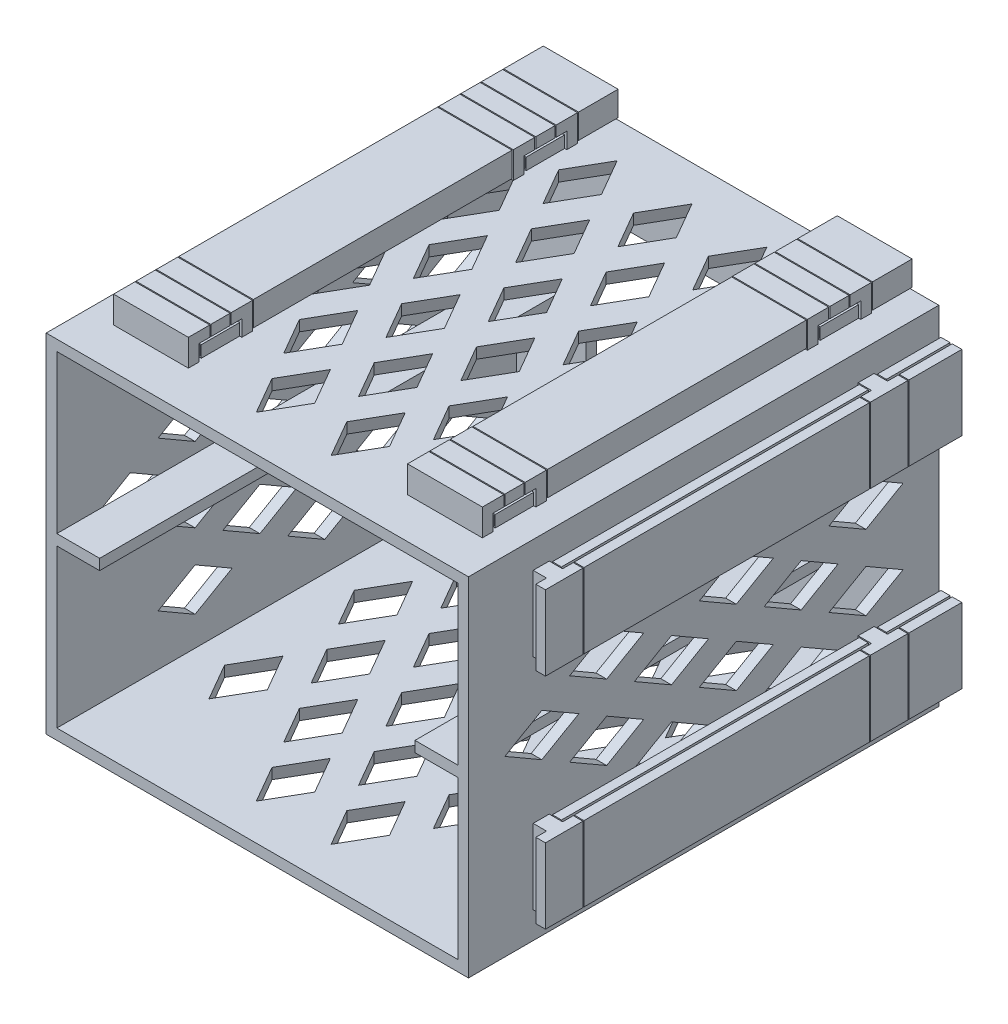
SolidWorks part; units mm, degrees
ref_plane "Alzado" through (0, 0, 0) normal (0, 0, 1) x (1, 0, 0)
ref_plane "Planta" through (0, 0, 0) normal (0, 1, 0) x (1, 0, 0)
ref_plane "Vista lateral" through (0, 0, 0) normal (1, 0, 0) x (0, 0, -1)
sketch "Croquis1" plane through (0, 0, 0) normal (0, 0, -1) x (-1, 0, 0)
  line L1 (-39.5, 32.5) -> (39.5, 32.5)
  line L2 (-39.5, 32.5) -> (-39.5, -32.5)
  line L3 (-39.5, -32.5) -> (39.5, -32.5)
  line L4 (39.5, 32.5) -> (39.5, -32.5)
  line L7 (-24.5, 17.5) -> (24.5, 17.5)
  line L8 (-24.5, 17.5) -> (-24.5, -17.5)
  line L9 (-24.5, -17.5) -> (24.5, -17.5)
  line L10 (24.5, 17.5) -> (24.5, -17.5)
extrude "Fondo" add sketch "Croquis1" against normal blind 2 separate body
sketch "Croquis3" plane through (0, 0, 2) normal (0, 0, 1) x (1, 0, 0)
  line L1 (-39.5, 32.5) -> (39.5, 32.5)
  line L2 (-39.5, 32.5) -> (-39.5, -32.5)
  line L3 (-39.5, -32.5) -> (39.5, -32.5)
  line L4 (39.5, 32.5) -> (39.5, -32.5)
  line L6 (-37.5, 30.5) -> (-37.5, -30.5)
  line L7 (-37.5, 30.5) -> (37.5, 30.5)
  line L8 (37.5, 30.5) -> (37.5, -30.5)
  line L9 (-37.5, -30.5) -> (37.5, -30.5)
extrude "Estructura" add sketch "Croquis3" along normal blind 86
sketch "Croquis5" plane through (-39.5, 0, 0) normal (-1, 0, 0) x (0, 0, 1)
  line L0 (13.628, 25) -> (20.556, 21)
  line L1 (20.556, 21) -> (13.628, 17)
  line L2 (13.628, 17) -> (6.7, 21)
  line L3 (6.7, 21) -> (13.628, 25)
  line L4 (0, -32.5) -> (0, 32.5) construction
  line L5 (88, 32.5) -> (0, 32.5) construction
  line L6 (13.628, 11) -> (20.556, 7)
  line L7 (6.7, 7) -> (13.628, 11)
  line L8 (13.628, 3) -> (6.7, 7)
  line L9 (20.556, 7) -> (13.628, 3)
  line L10 (13.628, -3) -> (20.556, -7)
  line L11 (6.7, -7) -> (13.628, -3)
  line L12 (13.628, -11) -> (6.7, -7)
  line L13 (20.556, -7) -> (13.628, -11)
  line L14 (13.628, -17) -> (20.556, -21)
  line L15 (6.7, -21) -> (13.628, -17)
  line L16 (13.628, -25) -> (6.7, -21)
  line L17 (20.556, -21) -> (13.628, -25)
  line L18 (37.884, 25) -> (44.812, 21)
  line L19 (44.812, 21) -> (37.884, 17)
  line L20 (37.884, 17) -> (30.956, 21)
  line L21 (30.956, 21) -> (37.884, 25)
  line L22 (44.812, 7) -> (37.884, 3)
  line L23 (37.884, 11) -> (44.812, 7)
  line L24 (30.956, 7) -> (37.884, 11)
  line L25 (37.884, 3) -> (30.956, 7)
  line L26 (44.812, -7) -> (37.884, -11)
  line L27 (37.884, -3) -> (44.812, -7)
  line L28 (30.956, -7) -> (37.884, -3)
  line L29 (37.884, -11) -> (30.956, -7)
  line L30 (37.884, -17) -> (44.812, -21)
  line L31 (44.812, -21) -> (37.884, -25)
  line L32 (37.884, -25) -> (30.956, -21)
  line L33 (30.956, -21) -> (37.884, -17)
  line L34 (62.14, 25) -> (69.068, 21)
  line L35 (69.068, 21) -> (62.14, 17)
  line L36 (62.14, 17) -> (55.212, 21)
  line L37 (55.212, 21) -> (62.14, 25)
  line L38 (69.068, 7) -> (62.14, 3)
  line L39 (62.14, 11) -> (69.068, 7)
  line L40 (55.212, 7) -> (62.14, 11)
  line L41 (62.14, 3) -> (55.212, 7)
  line L42 (69.068, -7) -> (62.14, -11)
  line L43 (62.14, -3) -> (69.068, -7)
  line L44 (55.212, -7) -> (62.14, -3)
  line L45 (62.14, -11) -> (55.212, -7)
  line L46 (62.14, -17) -> (69.068, -21)
  line L47 (69.068, -21) -> (62.14, -25)
  line L48 (62.14, -25) -> (55.212, -21)
  line L49 (55.212, -21) -> (62.14, -17)
  line L66 (50.012, 18) -> (56.94, 14)
  line L67 (56.94, 14) -> (50.012, 10)
  line L68 (50.012, 10) -> (43.084, 14)
  line L69 (43.084, 14) -> (50.012, 18)
  line L70 (50.012, 4) -> (56.94, 0)
  line L71 (43.084, 0) -> (50.012, 4)
  line L72 (50.012, -4) -> (43.084, 0)
  line L73 (56.94, -14) -> (50.012, -18)
  line L74 (50.012, -10) -> (56.94, -14)
  line L75 (43.084, -14) -> (50.012, -10)
  line L76 (18.828, 14) -> (25.756, 18)
  line L77 (67.34, 14) -> (74.268, 18) construction
  line L78 (67.34, -14) -> (74.268, -10) construction
  line L79 (74.268, -18) -> (67.34, -14) construction
  line L80 (25.756, 4) -> (32.684, 0)
  line L81 (18.828, 0) -> (25.756, 4)
  line L82 (25.756, -4) -> (18.828, 0)
  line L83 (32.684, 0) -> (25.756, -4)
  line L84 (25.756, -18) -> (18.828, -14)
  line L85 (32.684, -14) -> (25.756, -18)
  line L86 (56.94, 0) -> (50.012, -4)
  line L87 (50.012, -18) -> (43.084, -14)
  line L88 (32.684, 14) -> (25.756, 10)
  line L89 (25.756, 10) -> (18.828, 14)
  line L90 (25.756, 18) -> (32.684, 14)
  line L91 (74.268, 18) -> (81.196, 14) construction
  line L92 (81.196, 14) -> (74.268, 10) construction
  line L93 (74.268, 10) -> (67.34, 14) construction
  line L94 (81.196, 0) -> (74.268, -4)
  line L95 (74.268, 4) -> (81.196, 0)
  line L96 (67.34, 0) -> (74.268, 4)
  line L97 (74.268, -4) -> (67.34, 0)
  line L98 (81.196, -14) -> (74.268, -18) construction
  line L99 (74.268, -10) -> (81.196, -14) construction
  line L100 (25.756, -10) -> (32.684, -14)
  line L101 (18.828, -14) -> (25.756, -10)
  line L102 (88, 32.5) -> (0, 32.5) construction
  line L103 (86.396, 25) -> (93.324, 21)
  line L104 (93.324, 21) -> (86.396, 17)
  line L105 (86.396, 17) -> (79.468, 21)
  line L106 (79.468, 21) -> (86.396, 25)
  line L107 (93.324, 7) -> (86.396, 3)
  line L108 (86.396, 11) -> (93.324, 7)
  line L109 (79.468, 7) -> (86.396, 11)
  line L110 (86.396, 3) -> (79.468, 7)
  line L111 (93.324, -7) -> (86.396, -11)
  line L112 (86.396, -3) -> (93.324, -7)
  line L113 (79.468, -7) -> (86.396, -3)
  line L114 (86.396, -11) -> (79.468, -7)
  line L115 (86.396, -17) -> (93.324, -21)
  line L116 (93.324, -21) -> (86.396, -25)
  line L117 (86.396, -25) -> (79.468, -21)
  line L118 (79.468, -21) -> (86.396, -17)
  dimension "D1" = 7.9998
  dimension "D2" = 7.9998
  dimension "D3" = 6.7
  dimension "D4" = 7.5
  dimension "D5" = 8
  dimension "D7" = 13.856
  dimension "D9" = 24.256
  dimension "D10" = 14.5
  dimension "D11" = 24.256
  dimension "D6" = 4
  dimension "D8" = 4
extrude "RombosHor" cut sketch "Croquis5" against normal up to surface (79 mm away)
sketch "Croquis9" plane through (0, 32.5, 0) normal (0, 1, 0) x (1, 0, 0)
  line L0 (28, -6.6872) -> (24, -13.6154)
  line L1 (28, -6.6872) -> (32, -13.6154)
  line L2 (24, -13.6154) -> (28, -20.5436)
  line L3 (32, -13.6154) -> (28, -20.5436)
  line L4 (14, -6.6872) -> (10, -13.6154)
  line L5 (14, -6.6872) -> (18, -13.6154)
  line L6 (18, -13.6154) -> (14, -20.5436)
  line L7 (10, -13.6154) -> (14, -20.5436)
  line L8 (0, -6.6872) -> (-4, -13.6154)
  line L9 (0, -6.6872) -> (4, -13.6154)
  line L10 (4, -13.6154) -> (0, -20.5436)
  line L11 (-4, -13.6154) -> (0, -20.5436)
  line L12 (-14, -6.6872) -> (-18, -13.6154)
  line L13 (-14, -6.6872) -> (-10, -13.6154)
  line L14 (-10, -13.6154) -> (-14, -20.5436)
  line L15 (-18, -13.6154) -> (-14, -20.5436)
  line L16 (-28, -6.6872) -> (-32, -13.6154)
  line L17 (-28, -6.6872) -> (-24, -13.6154)
  line L18 (-24, -13.6154) -> (-28, -20.5436)
  line L19 (-32, -13.6154) -> (-28, -20.5436)
  line L20 (14, -30.9436) -> (10, -37.8718)
  line L21 (14, -30.9436) -> (18, -37.8718)
  line L22 (18, -37.8718) -> (14, -44.8)
  line L23 (10, -37.8718) -> (14, -44.8)
  line L24 (0, -30.9436) -> (-4, -37.8718)
  line L25 (0, -30.9436) -> (4, -37.8718)
  line L26 (4, -37.8718) -> (0, -44.8)
  line L27 (-4, -37.8718) -> (0, -44.8)
  line L28 (-14, -30.9436) -> (-18, -37.8718)
  line L29 (-14, -30.9436) -> (-10, -37.8718)
  line L30 (-10, -37.8718) -> (-14, -44.8)
  line L31 (-18, -37.8718) -> (-14, -44.8)
  line L32 (-28, -30.9436) -> (-32, -37.8718)
  line L33 (-28, -30.9436) -> (-24, -37.8718)
  line L34 (-24, -37.8718) -> (-28, -44.8)
  line L35 (-32, -37.8718) -> (-28, -44.8)
  line L36 (14, -55.2) -> (10, -62.1282)
  line L37 (14, -55.2) -> (18, -62.1282)
  line L38 (18, -62.1282) -> (14, -69.0564)
  line L39 (10, -62.1282) -> (14, -69.0564)
  line L40 (0, -55.2) -> (-4, -62.1282)
  line L41 (0, -55.2) -> (4, -62.1282)
  line L42 (4, -62.1282) -> (0, -69.0564)
  line L43 (-4, -62.1282) -> (0, -69.0564)
  line L44 (-14, -55.2) -> (-18, -62.1282)
  line L45 (-14, -55.2) -> (-10, -62.1282)
  line L46 (-10, -62.1282) -> (-14, -69.0564)
  line L47 (-18, -62.1282) -> (-14, -69.0564)
  line L48 (-28, -55.2) -> (-32, -62.1282)
  line L49 (-28, -55.2) -> (-24, -62.1282)
  line L50 (-24, -62.1282) -> (-28, -69.0564)
  line L51 (-32, -62.1282) -> (-28, -69.0564)
  line L68 (28, -30.9436) -> (24, -37.8718)
  line L69 (28, -30.9436) -> (32, -37.8718)
  line L70 (32, -37.8718) -> (28, -44.8)
  line L71 (24, -37.8718) -> (28, -44.8)
  line L72 (28, -55.2) -> (24, -62.1282)
  line L73 (28, -55.2) -> (32, -62.1282)
  line L74 (32, -62.1282) -> (28, -69.0564)
  line L75 (24, -62.1282) -> (28, -69.0564)
  line L80 (28, -6.6872) -> (14, -6.6872) construction
  line L81 (28, -6.6872) -> (28, -30.9436) construction
  line L83 (39.5, -88) -> (39.5, 0) construction
  line L87 (-39.5, 0) -> (39.5, 0) construction
  line L88 (17, -50.0018) -> (21, -56.93)
  line L89 (7, -67.33) -> (11, -74.2582)
  line L90 (-7, -67.33) -> (-11, -74.2582)
  line L91 (-7, -67.33) -> (-3, -74.2582)
  line L92 (-3, -74.2582) -> (-7, -81.1864)
  line L93 (-21, -67.33) -> (-25, -74.2582) construction
  line L94 (-21, -67.33) -> (-17, -74.2582) construction
  line L95 (-25, -74.2582) -> (-21, -81.1864) construction
  line L96 (21, -67.33) -> (25, -74.2582) construction
  line L97 (25, -74.2582) -> (21, -81.1864) construction
  line L98 (17, -74.2582) -> (21, -81.1864) construction
  line L99 (7, -18.8172) -> (3, -25.7454)
  line L100 (17, -25.7454) -> (21, -32.6736)
  line L101 (21, -18.8172) -> (25, -25.7454)
  line L102 (-7, -43.0736) -> (-11, -50.0018)
  line L103 (-3, -50.0018) -> (-7, -56.93)
  line L104 (-21, -43.0736) -> (-25, -50.0018)
  line L105 (-21, -43.0736) -> (-17, -50.0018)
  line L106 (-3, -25.7454) -> (-7, -32.6736)
  line L107 (-11, -25.7454) -> (-7, -32.6736)
  line L108 (-21, -18.8172) -> (-17, -25.7454)
  line L109 (-21, -18.8172) -> (-25, -25.7454)
  line L110 (-25, -25.7454) -> (-21, -32.6736)
  line L111 (21, -43.0736) -> (17, -50.0018)
  line L112 (11, -25.7454) -> (7, -32.6736)
  line L113 (7, -18.8172) -> (11, -25.7454)
  line L114 (7, -67.33) -> (3, -74.2582)
  line L115 (11, -74.2582) -> (7, -81.1864)
  line L116 (3, -74.2582) -> (7, -81.1864)
  line L117 (-11, -74.2582) -> (-7, -81.1864)
  line L118 (-17, -74.2582) -> (-21, -81.1864) construction
  line L119 (21, -67.33) -> (17, -74.2582) construction
  line L120 (7, -43.0736) -> (3, -50.0018)
  line L121 (7, -43.0736) -> (11, -50.0018)
  line L122 (11, -50.0018) -> (7, -56.93)
  line L123 (3, -50.0018) -> (7, -56.93)
  line L124 (21, -43.0736) -> (25, -50.0018)
  line L125 (25, -50.0018) -> (21, -56.93)
  line L126 (21, -18.8172) -> (17, -25.7454)
  line L127 (-7, -43.0736) -> (-3, -50.0018)
  line L128 (-11, -50.0018) -> (-7, -56.93)
  line L129 (-17, -50.0018) -> (-21, -56.93)
  line L130 (-25, -50.0018) -> (-21, -56.93)
  line L131 (-7, -18.8172) -> (-11, -25.7454)
  line L132 (-7, -18.8172) -> (-3, -25.7454)
  line L133 (-17, -25.7454) -> (-21, -32.6736)
  line L134 (3, -25.7454) -> (7, -32.6736)
  line L135 (25, -25.7454) -> (21, -32.6736)
  line L136 (18, -86.3846) -> (14, -93.3128)
  line L137 (10, -86.3846) -> (14, -93.3128)
  line L138 (4, -86.3846) -> (0, -93.3128)
  line L139 (-4, -86.3846) -> (0, -93.3128)
  line L140 (-10, -86.3846) -> (-14, -93.3128)
  line L141 (-18, -86.3846) -> (-14, -93.3128)
  line L142 (-24, -86.3846) -> (-28, -93.3128)
  line L143 (-32, -86.3846) -> (-28, -93.3128)
  line L144 (32, -86.3846) -> (28, -93.3128)
  line L145 (24, -86.3846) -> (28, -93.3128)
  line L146 (14, -79.4564) -> (10, -86.3846)
  line L147 (14, -79.4564) -> (18, -86.3846)
  line L148 (0, -79.4564) -> (-4, -86.3846)
  line L149 (0, -79.4564) -> (4, -86.3846)
  line L150 (-14, -79.4564) -> (-18, -86.3846)
  line L151 (-14, -79.4564) -> (-10, -86.3846)
  line L152 (-28, -79.4564) -> (-32, -86.3846)
  line L153 (-28, -79.4564) -> (-24, -86.3846)
  line L154 (28, -79.4564) -> (24, -86.3846)
  line L155 (28, -79.4564) -> (32, -86.3846)
  dimension "D1" = 8
  dimension "D2" = 8
  dimension "D3" = 8
  dimension "D4" = 13.8564
  dimension "D7" = 14
  dimension "D8" = 24.2564
  dimension "D9" = 6.6872
  dimension "D10" = 7.5
  dimension "D5" = 5
  dimension "D6" = 4
extrude "RombosVert" cut sketch "Croquis9" against normal up to surface (65 mm away)
sketch "Croquis8" plane through (0, 0, 2) normal (0, 0, 1) x (1, 0, 0)
  line L0 (-37.5, -30.5) -> (37.5, -30.5) construction
  line L1 (-29.5, -1) -> (-37.5, -1)
  line L2 (-29.5, -1) -> (-29.5, 1)
  line L3 (-29.5, 1) -> (-37.5, 1)
  line L4 (-37.5, -1) -> (-37.5, 1)
  line L5 (29.5, 1) -> (37.5, 1)
  line L6 (29.5, 1) -> (29.5, -1)
  line L7 (29.5, -1) -> (37.5, -1)
  line L8 (37.5, 1) -> (37.5, -1)
  dimension "D1" = 8
  dimension "D2" = 2
  dimension "D3" = 29.5
extrude "Guias" add sketch "Croquis8" along normal blind 86
sketch "Croquis10" plane through (39.5, 0, 0) normal (1, 0, 0) x (0, 0, -1)
  line L0 (-88, 32.5) -> (0, 32.5) construction
  line L1 (-12.104, -27.5) -> (-12.104, -13.5)
  line L2 (-15.104, -13.5) -> (-12.104, -13.5)
  line L3 (-15.104, -27.5) -> (-15.104, -13.5)
  line L4 (-15.104, -27.5) -> (-12.104, -27.5)
  line L5 (-88, 0) -> (0, 0) construction
  line L6 (-75.896, 27.5) -> (-75.896, 13.5)
  line L7 (-72.896, 13.5) -> (-75.896, 13.5)
  line L8 (-72.896, 27.5) -> (-72.896, 13.5)
  line L9 (0, 32.5) -> (0, -32.5) construction
  line L11 (-44, -32.5) -> (-44, 32.5) construction
  line L12 (-15.104, 27.5) -> (-12.104, 27.5)
  line L13 (-15.104, 27.5) -> (-15.104, 13.5)
  line L14 (-15.104, 13.5) -> (-12.104, 13.5)
  line L15 (-12.104, 27.5) -> (-12.104, 13.5)
  line L16 (-72.896, 27.5) -> (-75.896, 27.5)
  line L17 (-72.896, -27.5) -> (-75.896, -27.5)
  line L18 (-72.896, -27.5) -> (-72.896, -13.5)
  line L19 (-72.896, -13.5) -> (-75.896, -13.5)
  line L20 (-75.896, -27.5) -> (-75.896, -13.5)
  line L21 (-88, -32.5) -> (0, -32.5) construction
  dimension "D1" = 44
  dimension "D2" = 32.5
  dimension "D6" = 3
  dimension "D7" = 14
  dimension "D8" = 5
  dimension "D9" = 12.104
extrude "AncDer01" add sketch "Croquis10" along normal blind 2.5
sketch "Croquis11" plane through (42, 0, 0) normal (1, 0, 0) x (0, 0, -1)
  line L0 (-15.104, 13.5) -> (-12.104, 13.5) construction
  line L1 (0, 32.5) -> (0, -32.5) construction
  line L2 (-15.104, 27.5) -> (-15.104, 24.1478) construction
  line L3 (-17.104, 27.5) -> (-10.104, 27.5)
  line L4 (-17.104, 27.5) -> (-17.104, 13.5)
  line L5 (-44, 32.5) -> (-44, -32.5) construction
  line L6 (-12.104, 27.5) -> (-15.104, 27.5) construction
  line L7 (-10.104, -27.5) -> (-10.104, -13.5)
  line L8 (-17.104, 13.5) -> (-10.104, 13.5)
  line L9 (-17.104, -13.5) -> (-10.104, -13.5)
  line L10 (-88, 0) -> (0, 0) construction
  line L11 (-10.104, 27.5) -> (-10.104, 13.5)
  line L12 (-17.104, -27.5) -> (-17.104, -13.5)
  line L13 (-17.104, -27.5) -> (-10.104, -27.5)
  line L14 (-70.896, -27.5) -> (-77.896, -27.5)
  line L15 (-70.896, -27.5) -> (-70.896, -13.5)
  line L16 (-77.896, 27.5) -> (-77.896, 13.5)
  line L17 (-70.896, -13.5) -> (-77.896, -13.5)
  line L18 (-70.896, 13.5) -> (-77.896, 13.5)
  line L19 (-77.896, -27.5) -> (-77.896, -13.5)
  line L20 (-70.896, 27.5) -> (-70.896, 13.5)
  line L21 (-70.896, 27.5) -> (-77.896, 27.5)
  dimension "D1" = 44
  dimension "D2" = 88
  dimension "D3" = 7
  dimension "D4" = 2
extrude "AncDer02" add sketch "Croquis11" along normal blind 1.8
sketch "Croquis12" plane through (0, 32.5, 0) normal (0, 1, 0) x (1, 0, 0)
  line L1 (20.5, -9.604) -> (20.5, -7.604)
  line L2 (34.5, -7.604) -> (20.5, -7.604)
  line L3 (34.5, -9.604) -> (34.5, -7.604)
  line L4 (34.5, -9.604) -> (20.5, -9.604)
  line L5 (20.5, -19.604) -> (20.5, -17.604)
  line L6 (34.5, -17.604) -> (20.5, -17.604)
  line L7 (34.5, -19.604) -> (34.5, -17.604)
  line L8 (34.5, -19.604) -> (20.5, -19.604)
  line L10 (39.5, -44) -> (-39.5, -44) construction
  line L11 (-20.5, -78.396) -> (-20.5, -80.396)
  line L12 (-34.5, -80.396) -> (-20.5, -80.396)
  line L13 (0, -88) -> (0, 0) construction
  line L14 (-34.5, -78.396) -> (-34.5, -80.396)
  line L15 (-34.5, -78.396) -> (-20.5, -78.396)
  line L16 (-20.5, -68.396) -> (-20.5, -70.396)
  line L17 (-34.5, -70.396) -> (-20.5, -70.396)
  line L18 (-34.5, -68.396) -> (-34.5, -70.396)
  line L19 (-34.5, -68.396) -> (-20.5, -68.396)
  line L20 (34.5, -68.396) -> (20.5, -68.396)
  line L21 (-34.5, -19.604) -> (-20.5, -19.604)
  line L22 (-34.5, -19.604) -> (-34.5, -17.604)
  line L23 (-34.5, -17.604) -> (-20.5, -17.604)
  line L24 (-20.5, -19.604) -> (-20.5, -17.604)
  line L25 (-34.5, -9.604) -> (-20.5, -9.604)
  line L26 (-34.5, -9.604) -> (-34.5, -7.604)
  line L27 (-34.5, -7.604) -> (-20.5, -7.604)
  line L28 (-20.5, -9.604) -> (-20.5, -7.604)
  line L29 (34.5, -68.396) -> (34.5, -70.396)
  line L30 (34.5, -70.396) -> (20.5, -70.396)
  line L31 (20.5, -68.396) -> (20.5, -70.396)
  line L32 (34.5, -78.396) -> (20.5, -78.396)
  line L33 (34.5, -78.396) -> (34.5, -80.396)
  line L34 (34.5, -80.396) -> (20.5, -80.396)
  line L35 (20.5, -78.396) -> (20.5, -80.396)
  line L38 (-39.5, 0) -> (39.5, 0) construction
  line L39 (-39.5, -88) -> (-39.5, 0) construction
  dimension "D9" = 88
  dimension "D10" = 44
  dimension "D11" = 2
  dimension "D12" = 2
  dimension "D13" = 14
  dimension "D14" = 14
  dimension "D15" = 5
  dimension "D16" = 5
  dimension "D17" = 7.604
  dimension "D18" = 8
extrude "AncSup01" add sketch "Croquis12" along normal blind 3
sketch "Croquis13" plane through (0, 35.5, 0) normal (0, 1, 0) x (1, 0, 0)
  line L0 (39.5, -44) -> (-39.5, -44) construction
  line L2 (-39.5, 0) -> (39.5, 0) construction
  line L3 (-20.5, -9.604) -> (-20.5, -7.604) construction
  line L4 (-34.5, -7.604) -> (-20.5, -7.604)
  line L5 (-34.5, -7.604) -> (-34.5, -11.604)
  line L6 (-34.5, -11.604) -> (-20.5, -11.604)
  line L7 (-20.5, -7.604) -> (-20.5, -11.604)
  line L8 (-27.4575, -19.604) -> (-21.4543, -19.604) construction
  line L10 (-34.5, -19.604) -> (-20.5, -19.604)
  line L11 (0, 0) -> (0, -88) construction
  line L13 (-34.5, -19.604) -> (-34.5, -15.604)
  line L14 (-34.5, -15.604) -> (-20.5, -15.604)
  line L15 (-20.5, -19.604) -> (-20.5, -15.604)
  line L16 (-20.5, -19.604) -> (-20.5, -17.604) construction
  line L17 (20.5, -19.604) -> (20.5, -15.604)
  line L18 (34.5, -15.604) -> (20.5, -15.604)
  line L19 (34.5, -19.604) -> (34.5, -15.604)
  line L20 (34.5, -19.604) -> (20.5, -19.604)
  line L21 (20.5, -7.604) -> (20.5, -11.604)
  line L22 (34.5, -11.604) -> (20.5, -11.604)
  line L23 (34.5, -7.604) -> (34.5, -11.604)
  line L24 (34.5, -7.604) -> (20.5, -7.604)
  line L25 (34.5, -80.396) -> (20.5, -80.396)
  line L26 (34.5, -80.396) -> (34.5, -76.396)
  line L27 (34.5, -76.396) -> (20.5, -76.396)
  line L28 (20.5, -80.396) -> (20.5, -76.396)
  line L29 (34.5, -68.396) -> (20.5, -68.396)
  line L30 (34.5, -68.396) -> (34.5, -72.396)
  line L31 (34.5, -72.396) -> (20.5, -72.396)
  line L32 (20.5, -68.396) -> (20.5, -72.396)
  line L33 (-20.5, -68.396) -> (-20.5, -72.396)
  line L34 (-34.5, -72.396) -> (-20.5, -72.396)
  line L35 (-34.5, -68.396) -> (-34.5, -72.396)
  line L36 (-34.5, -68.396) -> (-20.5, -68.396)
  line L37 (-20.5, -80.396) -> (-20.5, -76.396)
  line L38 (-34.5, -76.396) -> (-20.5, -76.396)
  line L39 (-34.5, -80.396) -> (-34.5, -76.396)
  line L40 (-34.5, -80.396) -> (-20.5, -80.396)
  dimension "D1" = 44
  dimension "D2" = 88
  dimension "D3" = 4
  dimension "D4" = 4
extrude "AncSup02" add sketch "Croquis13" along normal blind 2
sketch "Croquis52" plane through (-39.5, 0, 0) normal (-1, 0, 0) x (0, 0, 1)
  line L0 (0, -32.5) -> (0, 32.5) construction
  line L1 (88, 32.5) -> (0, 32.5) construction
  line L2 (9.604, -27.5) -> (7.604, -27.5)
  line L3 (9.604, -27.5) -> (9.604, -13.5)
  line L4 (9.604, -13.5) -> (7.604, -13.5)
  line L5 (7.604, -27.5) -> (7.604, -13.5)
  line L6 (19.604, -27.5) -> (17.604, -27.5)
  line L7 (19.604, -27.5) -> (19.604, -13.5)
  line L8 (19.604, -13.5) -> (17.604, -13.5)
  line L9 (44, 32.5) -> (44, -32.5) construction
  line L10 (17.604, -27.5) -> (17.604, -13.5)
  line L11 (78.396, 27.5) -> (80.396, 27.5)
  line L12 (78.396, 27.5) -> (78.396, 13.5)
  line L13 (78.396, 13.5) -> (80.396, 13.5)
  line L14 (80.396, 27.5) -> (80.396, 13.5)
  line L15 (68.396, 27.5) -> (70.396, 27.5)
  line L16 (88, 0) -> (0, 0) construction
  line L17 (68.396, 27.5) -> (68.396, 13.5)
  line L18 (68.396, 13.5) -> (70.396, 13.5)
  line L19 (70.396, 27.5) -> (70.396, 13.5)
  line L20 (70.396, -27.5) -> (70.396, -13.5)
  line L21 (68.396, -13.5) -> (70.396, -13.5)
  line L22 (68.396, -27.5) -> (68.396, -13.5)
  line L23 (68.396, -27.5) -> (70.396, -27.5)
  line L24 (80.396, -27.5) -> (80.396, -13.5)
  line L25 (78.396, -13.5) -> (80.396, -13.5)
  line L26 (78.396, -27.5) -> (78.396, -13.5)
  line L27 (78.396, -27.5) -> (80.396, -27.5)
  line L32 (17.604, 27.5) -> (17.604, 13.5)
  line L33 (19.604, 13.5) -> (17.604, 13.5)
  line L34 (19.604, 27.5) -> (19.604, 13.5)
  line L35 (19.604, 27.5) -> (17.604, 27.5)
  line L36 (7.604, 27.5) -> (7.604, 13.5)
  line L37 (9.604, 13.5) -> (7.604, 13.5)
  line L38 (9.604, 27.5) -> (9.604, 13.5)
  line L39 (9.604, 27.5) -> (7.604, 27.5)
  dimension "D1" = 44
  dimension "D2" = 88
  dimension "D3" = 2
  dimension "D4" = 2
  dimension "D5" = 8
  dimension "D6" = 14
  dimension "D7" = 14
  dimension "D8" = 7.604
  dimension "D9" = 5
  dimension "D10" = 5
extrude "AncIzq01" [suppressed] add sketch "Croquis52" along normal blind 3
sketch "Croquis53" [suppressed] plane through (-42.5, 0, 0) normal (-1, 0, 0) x (0, 0, 1)
  line L0 (44, 32.5) -> (44, -32.5) construction
  line L1 (0, -32.5) -> (0, 32.5) construction
  line L2 (7.604, 13.5) -> (9.604, 13.5) construction
  line L3 (7.604, 27.5) -> (11.604, 27.5)
  line L4 (7.604, 27.5) -> (7.604, 13.5)
  line L5 (7.604, 13.5) -> (11.604, 13.5)
  line L6 (11.604, 27.5) -> (11.604, 13.5)
  line L7 (17.604, 13.5) -> (19.604, 13.5) construction
  line L8 (19.604, 27.5) -> (15.604, 27.5)
  line L10 (19.604, 27.5) -> (19.604, 13.5)
  line L12 (88, 0) -> (0, 0) construction
  line L13 (19.604, 13.5) -> (15.604, 13.5)
  line L14 (15.604, 27.5) -> (15.604, 13.5)
  line L15 (15.604, -27.5) -> (15.604, -13.5)
  line L16 (19.604, -13.5) -> (15.604, -13.5)
  line L17 (19.604, -27.5) -> (19.604, -13.5)
  line L18 (19.604, -27.5) -> (15.604, -27.5)
  line L19 (11.604, -27.5) -> (11.604, -13.5)
  line L20 (7.604, -13.5) -> (11.604, -13.5)
  line L21 (7.604, -27.5) -> (7.604, -13.5)
  line L22 (7.604, -27.5) -> (11.604, -27.5)
  line L23 (80.396, -27.5) -> (76.396, -27.5)
  line L24 (80.396, -27.5) -> (80.396, -13.5)
  line L25 (80.396, -13.5) -> (76.396, -13.5)
  line L26 (76.396, -27.5) -> (76.396, -13.5)
  line L27 (68.396, -27.5) -> (72.396, -27.5)
  line L28 (68.396, -27.5) -> (68.396, -13.5)
  line L29 (68.396, -13.5) -> (72.396, -13.5)
  line L30 (72.396, -27.5) -> (72.396, -13.5)
  line L31 (72.396, 27.5) -> (72.396, 13.5)
  line L32 (68.396, 13.5) -> (72.396, 13.5)
  line L33 (68.396, 27.5) -> (68.396, 13.5)
  line L34 (68.396, 27.5) -> (72.396, 27.5)
  line L35 (76.396, 27.5) -> (76.396, 13.5)
  line L36 (80.396, 13.5) -> (76.396, 13.5)
  line L37 (80.396, 27.5) -> (80.396, 13.5)
  line L38 (80.396, 27.5) -> (76.396, 27.5)
  dimension "D1" = 44
  dimension "D2" = 88
  dimension "D3" = 4
  dimension "D4" = 4
extrude "AncIzq02" [suppressed] add sketch "Croquis53" along normal blind 2
sketch "Croquis54" plane through (0, -32.5, 0) normal (0, -1, 0) x (1, 0, 0)
  line L0 (0, 88) -> (0, 0) construction
  line L1 (-34.5, 15.104) -> (-20.5, 15.104)
  line L2 (-34.5, 15.104) -> (-34.5, 12.104)
  line L3 (-34.5, 12.104) -> (-20.5, 12.104)
  line L4 (-20.5, 15.104) -> (-20.5, 12.104)
  line L5 (-39.5, 88) -> (39.5, 88) construction
  line L6 (-39.5, 44) -> (39.5, 44) construction
  line L7 (-39.5, 88) -> (-39.5, 0) construction
  line L8 (39.5, 88) -> (39.5, 0) construction
  line L9 (39.5, 0) -> (-39.5, 0) construction
  line L10 (20.5, 15.104) -> (20.5, 12.104)
  line L11 (34.5, 12.104) -> (20.5, 12.104)
  line L12 (34.5, 15.104) -> (34.5, 12.104)
  line L13 (34.5, 15.104) -> (20.5, 15.104)
  line L14 (34.5, 72.896) -> (20.5, 72.896)
  line L15 (34.5, 72.896) -> (34.5, 75.896)
  line L16 (34.5, 75.896) -> (20.5, 75.896)
  line L17 (20.5, 72.896) -> (20.5, 75.896)
  line L18 (-20.5, 72.896) -> (-20.5, 75.896)
  line L19 (-34.5, 75.896) -> (-20.5, 75.896)
  line L20 (-34.5, 72.896) -> (-34.5, 75.896)
  line L21 (-34.5, 72.896) -> (-20.5, 72.896)
  dimension "D1" = 3
  dimension "D2" = 14
  dimension "D3" = 5
  dimension "D4" = 12.104
extrude "AncInf01" [suppressed] add sketch "Croquis54" along normal blind 2.5
sketch "Croquis55" [suppressed] plane through (0, -35, 0) normal (0, -1, 0) x (1, 0, 0)
  line L1 (-34.5, 77.896) -> (-20.5, 77.896)
  line L2 (-34.5, 77.896) -> (-34.5, 70.896)
  line L3 (-34.5, 70.896) -> (-20.5, 70.896)
  line L4 (-20.5, 77.896) -> (-20.5, 70.896)
  line L6 (-20.5, 72.896) -> (-20.5, 75.896) construction
  line L7 (-34.5, 75.896) -> (-34.5, 72.896) construction
  line L8 (-34.5, 72.896) -> (-20.5, 72.896) construction
  line L9 (-39.5, 44) -> (39.5, 44) construction
  line L10 (-39.5, 88) -> (-39.5, 0) construction
  line L11 (39.5, 88) -> (39.5, 0) construction
  line L12 (0, 88) -> (0, 0) construction
  line L13 (-39.5, 88) -> (39.5, 88) construction
  line L14 (20.5, 77.896) -> (20.5, 70.896)
  line L15 (34.5, 70.896) -> (20.5, 70.896)
  line L16 (34.5, 77.896) -> (34.5, 70.896)
  line L17 (34.5, 77.896) -> (20.5, 77.896)
  line L18 (34.5, 10.104) -> (20.5, 10.104)
  line L19 (34.5, 10.104) -> (34.5, 17.104)
  line L20 (34.5, 17.104) -> (20.5, 17.104)
  line L21 (20.5, 10.104) -> (20.5, 17.104)
  line L22 (-20.5, 10.104) -> (-20.5, 17.104)
  line L23 (-34.5, 17.104) -> (-20.5, 17.104)
  line L24 (-34.5, 10.104) -> (-34.5, 17.104)
  line L25 (-34.5, 10.104) -> (-20.5, 10.104)
  dimension "D1" = 7
  dimension "D2" = 2
extrude "AncInf02" [suppressed] add sketch "Croquis55" along normal blind 1.8
sketch "Croquis61" plane through (0, 0, 0) normal (0, 0, -1) x (-1, 0, 0)
  line L1 (20.5, 32.9) -> (34.5, 32.9)
  line L2 (20.5, 32.9) -> (20.5, 37.5)
  line L3 (20.5, 37.5) -> (34.5, 37.5)
  line L4 (34.5, 32.9) -> (34.5, 37.5)
  line L5 (20.7, 33.1) -> (20.7, 37.3)
  line L6 (20.7, 37.3) -> (34.3, 37.3)
  line L7 (34.3, 33.1) -> (34.3, 37.3)
  line L8 (20.7, 33.1) -> (34.3, 33.1)
  line L9 (0, 32.5) -> (0, 17.5) construction
  line L10 (39.5, 32.5) -> (-39.5, 32.5) construction
  line L11 (24.5, 17.5) -> (-24.5, 17.5) construction
  line L12 (-20.7, 33.1) -> (-34.3, 33.1)
  line L13 (-34.3, 33.1) -> (-34.3, 37.3)
  line L14 (-20.7, 37.3) -> (-34.3, 37.3)
  line L15 (-20.7, 33.1) -> (-20.7, 37.3)
  line L16 (-34.5, 32.9) -> (-34.5, 37.5)
  line L17 (-20.5, 37.5) -> (-34.5, 37.5)
  line L18 (-20.5, 32.9) -> (-20.5, 37.5)
  line L19 (-20.5, 32.9) -> (-34.5, 32.9)
  dimension "D1" = 0.2
extrude "EspAncSup01" add sketch "Croquis61" against normal blind 7.404 separate body
ref_plane "PlanoEspAncSup01" through (0, 0, 19.804) normal (0, 0, 1) x (1, 0, 0)
sketch "Croquis57" plane through (0, 0, 19.804) normal (0, 0, 1) x (1, 0, 0)
  line L1 (34.5, 37.5) -> (20.5457, 37.5)
  line L2 (34.5, 37.5) -> (34.5, 32.9)
  line L3 (34.5, 32.9) -> (20.5457, 32.9)
  line L4 (20.5457, 37.5) -> (20.5457, 32.9)
  line L5 (34.3, 37.3) -> (34.3, 33.1)
  line L6 (34.3, 33.1) -> (20.7457, 33.1)
  line L7 (20.7457, 37.3) -> (20.7457, 33.1)
  line L8 (34.3, 37.3) -> (20.7457, 37.3)
  line L9 (0, 32.5) -> (0, 17.5) construction
  line L10 (-24.5, 17.5) -> (24.5, 17.5) construction
  line L11 (-34.3, 37.3) -> (-20.7457, 37.3)
  line L12 (-20.7457, 37.3) -> (-20.7457, 33.1)
  line L13 (-34.3, 33.1) -> (-20.7457, 33.1)
  line L14 (-34.3, 37.3) -> (-34.3, 33.1)
  line L15 (-20.5457, 37.5) -> (-20.5457, 32.9)
  line L16 (-34.5, 32.9) -> (-20.5457, 32.9)
  line L17 (-34.5, 37.5) -> (-34.5, 32.9)
  line L18 (-34.5, 37.5) -> (-20.5457, 37.5)
  dimension "D1" = 0.2
sketch "Croquis58" plane through (0, 0, 19.804) normal (0, 0, 1) x (1, 0, 0)
  line L0 (33.8, 36.8) -> (33.8, 33.6)
  line L1 (0, 32.5) -> (0, 17.5) construction
  line L2 (-33.6, 36.6) -> (-21.4457, 36.6)
  line L3 (-21.4457, 36.6) -> (-21.4457, 33.8)
  line L4 (-33.6, 33.8) -> (-21.4457, 33.8)
  line L5 (33.8, 33.6) -> (21.2457, 33.6)
  line L6 (21.2457, 36.8) -> (21.2457, 33.6)
  line L7 (33.8, 36.8) -> (21.2457, 36.8)
  line L8 (33.6, 36.6) -> (33.6, 33.8)
  line L9 (33.6, 33.8) -> (21.4457, 33.8)
  line L10 (21.4457, 36.6) -> (21.4457, 33.8)
  line L11 (33.6, 36.6) -> (21.4457, 36.6)
  line L12 (-33.6, 36.6) -> (-33.6, 33.8)
  line L13 (-33.8, 36.8) -> (-21.2457, 36.8)
  line L14 (-21.2457, 36.8) -> (-21.2457, 33.6)
  line L15 (-33.8, 33.6) -> (-21.2457, 33.6)
  line L16 (-33.8, 36.8) -> (-33.8, 33.6)
  dimension "D2" = 0.2
sketch "Croquis59" plane through (0, 0, 19.804) normal (0, 0, 1) x (1, 0, 0)
  line L0 (33.1, 36.1) -> (33.1, 34.3)
  line L1 (0, 32.5) -> (0, 17.5) construction
  line L2 (-32.9, 35.9) -> (-22.1457, 35.9)
  line L3 (-22.1457, 35.9) -> (-22.1457, 34.5)
  line L4 (-32.9, 34.5) -> (-22.1457, 34.5)
  line L5 (33.1, 34.3) -> (21.9457, 34.3)
  line L6 (21.9457, 36.1) -> (21.9457, 34.3)
  line L7 (33.1, 36.1) -> (21.9457, 36.1)
  line L8 (32.9, 35.9) -> (32.9, 34.5)
  line L9 (32.9, 34.5) -> (22.1457, 34.5)
  line L10 (22.1457, 35.9) -> (22.1457, 34.5)
  line L11 (32.9, 35.9) -> (22.1457, 35.9)
  line L12 (-32.9, 35.9) -> (-32.9, 34.5)
  line L13 (-33.1, 36.1) -> (-21.9457, 36.1)
  line L14 (-21.9457, 36.1) -> (-21.9457, 34.3)
  line L15 (-33.1, 34.3) -> (-21.9457, 34.3)
  line L16 (-33.1, 36.1) -> (-33.1, 34.3)
  dimension "D2" = 0.2
extrude "EspAncSup02" add sketch "Croquis57" along normal blind 48.392
extrude "EspAncSup03" add sketch "Croquis58" along normal blind 48.392 separate body
extrude "EspAncSup04" add sketch "Croquis59" along normal blind 48.392 separate body
ref_plane "PlanoEspAncSup02" through (0, 32.9, 0) normal (0, 1, 0) x (1, 0, 0)
sketch "Croquis64" plane through (0, 32.9, 0) normal (0, 1, 0) x (1, 0, 0)
  line L0 (-34.5, -9.604) -> (-29.684, -9.604) construction
  line L1 (-20.5, -17.204) -> (-34.5, -17.204)
  line L2 (-20.5, -17.204) -> (-20.5, -10.004)
  line L3 (-20.5, -10.004) -> (-34.5, -10.004)
  line L4 (-34.5, -17.204) -> (-34.5, -10.004)
  line L5 (-29.6972, -17.604) -> (-34.5, -17.604) construction
  line L6 (-34.5, -7.604) -> (-34.5, -9.604) construction
  line L7 (-39.5, -44) -> (39.5, -44) construction
  line L8 (-39.5, -88) -> (-39.5, 0) construction
  line L9 (39.5, -88) -> (39.5, 0) construction
  line L10 (0, 0) -> (0, -88) construction
  line L11 (39.5, -88) -> (-39.5, -88) construction
  line L12 (34.5, -17.204) -> (34.5, -10.004)
  line L13 (20.5, -10.004) -> (34.5, -10.004)
  line L14 (20.5, -17.204) -> (20.5, -10.004)
  line L15 (20.5, -17.204) -> (34.5, -17.204)
  line L16 (20.5, -70.796) -> (34.5, -70.796)
  line L17 (20.5, -70.796) -> (20.5, -77.996)
  line L18 (20.5, -77.996) -> (34.5, -77.996)
  line L19 (34.5, -70.796) -> (34.5, -77.996)
  line L20 (-34.5, -70.796) -> (-34.5, -77.996)
  line L21 (-20.5, -77.996) -> (-34.5, -77.996)
  line L22 (-20.5, -70.796) -> (-20.5, -77.996)
  line L23 (-20.5, -70.796) -> (-34.5, -70.796)
  dimension "D1" = 0.4
  dimension "D2" = 0.4
  dimension "D3" = 14
extrude "EspAncSup05" add sketch "Croquis64" along normal blind 2.2
sketch "Croquis66" plane through (0, 0, 17.204) normal (0, 0, 1) x (1, 0, 0)
  line L0 (-34.3, 34.9) -> (-34.3, 33.1)
  line L1 (0, 17.5) -> (0, 30.5) construction
  line L2 (-24.5, 17.5) -> (24.5, 17.5) construction
  line L3 (37.5, 30.5) -> (-37.5, 30.5) construction
  line L4 (34.3, 34.9) -> (20.7, 34.9)
  line L5 (-34.3, 33.1) -> (-20.7, 33.1)
  line L6 (-20.7, 34.9) -> (-20.7, 33.1)
  line L7 (-34.3, 34.9) -> (-20.7, 34.9)
  line L8 (20.7, 34.9) -> (20.7, 33.1)
  line L9 (34.3, 33.1) -> (20.7, 33.1)
  line L10 (34.3, 34.9) -> (34.3, 33.1)
extrude "EspAncSup06" cut sketch "Croquis66" against normal up to next (7.2 mm away)
sketch "Croquis68" plane through (0, 0, 77.996) normal (0, 0, 1) x (1, 0, 0)
  line L0 (34.3, 34.9) -> (34.3, 33.1)
  line L1 (0, 17.5) -> (0, 32.5) construction
  line L2 (-24.5, 17.5) -> (24.5, 17.5) construction
  line L3 (-34.3, 34.9) -> (-20.7, 34.9)
  line L4 (-20.7, 34.9) -> (-20.7, 33.1)
  line L5 (34.3, 33.1) -> (20.7, 33.1)
  line L6 (20.7, 34.9) -> (20.7, 33.1)
  line L7 (34.3, 34.9) -> (20.7, 34.9)
  line L8 (-34.3, 33.1) -> (-20.7, 33.1)
  line L9 (-34.3, 34.9) -> (-34.3, 33.1)
extrude "EspAncSup07" cut sketch "Croquis68" against normal up to next (7.2 mm away)
sketch "Croquis70" plane through (0, 35.5, 0) normal (0, -1, 0) x (1, 0, 0)
  line L1 (20.5, 70.396) -> (20.5, 72.396) construction
  line L2 (20.5, 72.396) -> (34.5, 72.396) construction
  line L3 (34.5, 76.396) -> (20.5, 76.396) construction
  line L4 (34.5, 72.396) -> (34.5, 70.396) construction
  line L5 (-34.5, 76.196) -> (-34.5, 72.596)
  line L6 (-20.5, 72.596) -> (-34.5, 72.596)
  line L7 (-20.5, 76.196) -> (-20.5, 72.596)
  line L8 (0, 88) -> (0, 0) construction
  line L9 (39.5, 88) -> (-39.5, 88) construction
  line L10 (39.5, 44) -> (-39.5, 44) construction
  line L11 (39.5, 88) -> (39.5, 0) construction
  line L12 (-39.5, 88) -> (-39.5, 0) construction
  line L13 (-20.5, 76.196) -> (-34.5, 76.196)
  line L14 (34.5, 11.804) -> (34.5, 15.404)
  line L15 (20.5, 15.404) -> (34.5, 15.404)
  line L16 (20.5, 11.804) -> (20.5, 15.404)
  line L17 (20.5, 76.196) -> (34.5, 76.196)
  line L18 (20.5, 76.196) -> (20.5, 72.596)
  line L19 (20.5, 72.596) -> (34.5, 72.596)
  line L20 (34.5, 76.196) -> (34.5, 72.596)
  line L21 (20.5, 11.804) -> (34.5, 11.804)
  line L22 (-20.5, 11.804) -> (-34.5, 11.804)
  line L23 (-20.5, 11.804) -> (-20.5, 15.404)
  line L24 (-20.5, 15.404) -> (-34.5, 15.404)
  line L25 (-34.5, 11.804) -> (-34.5, 15.404)
  dimension "D1" = 0.2
  dimension "D2" = 0.2
extrude "EspAncSup08" add sketch "Croquis70" against normal blind 2 separate body
sketch "Croquis71" plane through (0, 0, 72.596) normal (0, 0, -1) x (-1, 0, 0)
  line L0 (-34.3, 37.3) -> (-34.3, 35.7)
  line L2 (0, 32.5) -> (0, 17.5) construction
  line L3 (39.5, 32.5) -> (-39.5, 32.5) construction
  line L4 (24.5, 17.5) -> (-24.5, 17.5) construction
  line L5 (-20.7, 35.7) -> (-34.3, 35.7)
  line L6 (-20.7, 37.3) -> (-20.7, 35.7)
  line L7 (-20.7, 37.3) -> (-34.3, 37.3)
  line L8 (20.7, 37.3) -> (34.3, 37.3)
  line L9 (20.7, 37.3) -> (20.7, 35.7)
  line L10 (20.7, 35.7) -> (34.3, 35.7)
  line L11 (34.3, 37.3) -> (34.3, 35.7)
extrude "EspAncSup09" cut sketch "Croquis71" against normal up to next (3.6 mm away)
sketch "Croquis72" plane through (0, 0, 11.804) normal (0, 0, -1) x (-1, 0, 0)
  line L0 (-34.3, 37.3) -> (-34.3, 35.7)
  line L1 (0, 32.5) -> (0, 17.5) construction
  line L2 (39.5, 32.5) -> (-39.5, 32.5) construction
  line L3 (24.5, 17.5) -> (-24.5, 17.5) construction
  line L4 (34.3, 37.3) -> (20.7, 37.3)
  line L5 (-34.3, 35.7) -> (-20.7, 35.7)
  line L6 (-20.7, 37.3) -> (-20.7, 35.7)
  line L7 (-34.3, 37.3) -> (-20.7, 37.3)
  line L8 (20.7, 37.3) -> (20.7, 35.7)
  line L9 (34.3, 35.7) -> (20.7, 35.7)
  line L10 (34.3, 37.3) -> (34.3, 35.7)
extrude "EspAncSup10" cut sketch "Croquis72" against normal up to next (3.6 mm away)
sketch "Croquis73" plane through (0, 0, 0) normal (0, 0, -1) x (-1, 0, 0)
  line L1 (39.9, 27.5) -> (44.5, 27.5)
  line L2 (39.9, 27.5) -> (39.9, 13.5)
  line L3 (39.9, 13.5) -> (44.5, 13.5)
  line L4 (44.5, 27.5) -> (44.5, 13.5)
  line L6 (39.5, 0) -> (24.5, 0) construction
  line L7 (39.5, -32.5) -> (39.5, 32.5) construction
  line L8 (24.5, -17.5) -> (24.5, 17.5) construction
  line L9 (40.1, -27.3) -> (40.1, -13.7)
  line L10 (40.1, -13.7) -> (44.3, -13.7)
  line L11 (44.3, -27.3) -> (44.3, -13.7)
  line L12 (40.1, -27.3) -> (44.3, -27.3)
  line L13 (40.1, 27.3) -> (44.3, 27.3)
  line L14 (44.3, 27.3) -> (44.3, 13.7)
  line L15 (40.1, 13.7) -> (44.3, 13.7)
  line L16 (40.1, 27.3) -> (40.1, 13.7)
  line L17 (44.5, -27.5) -> (44.5, -13.5)
  line L18 (39.9, -13.5) -> (44.5, -13.5)
  line L19 (39.9, -27.5) -> (39.9, -13.5)
  line L20 (39.9, -27.5) -> (44.5, -27.5)
  dimension "D1" = 0.2
extrude "EspAncIzq01" [suppressed] add sketch "Croquis73" against normal blind 7.404 separate body
sketch "Croquis74" plane through (0, 0, 19.804) normal (0, 0, 1) x (1, 0, 0)
  line L1 (-39.9, 27.5) -> (-44.5, 27.5)
  line L2 (-39.9, 27.5) -> (-39.9, 13.5)
  line L3 (-39.9, 13.5) -> (-44.5, 13.5)
  line L4 (-44.5, 27.5) -> (-44.5, 13.5)
  line L5 (-40.1, 27.3) -> (-44.3, 27.3)
  line L6 (-44.3, 27.3) -> (-44.3, 13.7)
  line L7 (-40.1, 13.7) -> (-44.3, 13.7)
  line L8 (-40.1, 27.3) -> (-40.1, 13.7)
  line L9 (-39.5, 0) -> (-24.5, 0) construction
  line L10 (-39.5, 32.5) -> (-39.5, -32.5) construction
  line L11 (-24.5, -17.5) -> (-24.5, 17.5) construction
  line L12 (-40.1, -27.3) -> (-40.1, -13.7)
  line L13 (-40.1, -13.7) -> (-44.3, -13.7)
  line L14 (-44.3, -27.3) -> (-44.3, -13.7)
  line L15 (-40.1, -27.3) -> (-44.3, -27.3)
  line L16 (-44.5, -27.5) -> (-44.5, -13.5)
  line L17 (-39.9, -13.5) -> (-44.5, -13.5)
  line L18 (-39.9, -27.5) -> (-39.9, -13.5)
  line L19 (-39.9, -27.5) -> (-44.5, -27.5)
  dimension "D1" = 0.2
sketch "Croquis75" plane through (0, 0, 19.804) normal (0, 0, 1) x (1, 0, 0)
  line L0 (-40.6, 26.8) -> (-40.6, 14.2)
  line L1 (-39.5, 0) -> (-24.5, 0) construction
  line L2 (-40.8, -26.6) -> (-40.8, -14.4)
  line L3 (-40.8, -14.4) -> (-43.6, -14.4)
  line L4 (-43.6, -26.6) -> (-43.6, -14.4)
  line L5 (-40.6, 14.2) -> (-43.8, 14.2)
  line L6 (-43.8, 26.8) -> (-43.8, 14.2)
  line L7 (-40.6, 26.8) -> (-43.8, 26.8)
  line L8 (-40.8, 26.6) -> (-43.6, 26.6)
  line L9 (-43.6, 26.6) -> (-43.6, 14.4)
  line L10 (-40.8, 14.4) -> (-43.6, 14.4)
  line L11 (-40.8, 26.6) -> (-40.8, 14.4)
  line L12 (-40.8, -26.6) -> (-43.6, -26.6)
  line L13 (-40.6, -26.8) -> (-43.8, -26.8)
  line L14 (-43.8, -26.8) -> (-43.8, -14.2)
  line L15 (-40.6, -14.2) -> (-43.8, -14.2)
  line L16 (-40.6, -26.8) -> (-40.6, -14.2)
  dimension "D2" = 0.2
sketch "Croquis76" plane through (0, 0, 19.804) normal (0, 0, 1) x (1, 0, 0)
  line L0 (-41.3, 26.1) -> (-41.3, 14.9)
  line L1 (-39.5, 0) -> (-24.5, 0) construction
  line L2 (-41.5, -25.9) -> (-42.9, -25.9)
  line L3 (-42.9, -25.9) -> (-42.9, -15.1)
  line L4 (-41.5, -15.1) -> (-42.9, -15.1)
  line L5 (-41.3, 14.9) -> (-43.1, 14.9)
  line L6 (-43.1, 26.1) -> (-43.1, 14.9)
  line L7 (-41.3, 26.1) -> (-43.1, 26.1)
  line L8 (-41.5, 25.9) -> (-41.5, 15.1)
  line L9 (-41.5, 15.1) -> (-42.9, 15.1)
  line L10 (-42.9, 25.9) -> (-42.9, 15.1)
  line L11 (-41.5, 25.9) -> (-42.9, 25.9)
  line L12 (-41.5, -25.9) -> (-41.5, -15.1)
  line L13 (-41.3, -26.1) -> (-43.1, -26.1)
  line L14 (-43.1, -26.1) -> (-43.1, -14.9)
  line L15 (-41.3, -14.9) -> (-43.1, -14.9)
  line L16 (-41.3, -26.1) -> (-41.3, -14.9)
  dimension "D2" = 0.2
extrude "EspAncIzq02" [suppressed] add sketch "Croquis74" along normal blind 48.392 separate body
extrude "EspAncIzq03" [suppressed] add sketch "Croquis75" along normal blind 48.392 separate body
extrude "EspAncIzq04" [suppressed] add sketch "Croquis76" along normal blind 48.392 separate body
ref_plane "PlanoEspAncIzq01" [suppressed] through (-39.9, 0, 0) normal (-1, 0, 0) x (0, 0, 1)
sketch "Croquis77" [suppressed] plane through (-39.9, 0, 0) normal (-1, 0, 0) x (0, 0, 1)
  line L1 (9.804, 13.5) -> (17.404, 13.5)
  line L2 (9.804, 13.5) -> (9.804, 27.5)
  line L3 (9.804, 27.5) -> (17.404, 27.5)
  line L4 (17.404, 13.5) -> (17.404, 27.5)
  line L5 (19.604, 27.5) -> (17.604, 27.5) construction
  line L7 (7.604, 13.5) -> (9.604, 13.5) construction
  line L8 (44, 32.5) -> (44, -32.5) construction
  line L9 (88, 32.5) -> (0, 32.5) construction
  line L10 (88, -32.5) -> (0, -32.5) construction
  line L11 (88, 0) -> (0, 0) construction
  line L12 (88, 32.5) -> (88, -32.5) construction
  line L13 (0, -32.5) -> (0, 32.5) construction
  line L14 (70.596, 13.5) -> (70.596, 27.5)
  line L15 (78.196, 27.5) -> (70.596, 27.5)
  line L16 (78.196, 13.5) -> (78.196, 27.5)
  line L17 (78.196, 13.5) -> (70.596, 13.5)
  line L18 (78.196, -13.5) -> (70.596, -13.5)
  line L19 (78.196, -13.5) -> (78.196, -27.5)
  line L20 (78.196, -27.5) -> (70.596, -27.5)
  line L21 (70.596, -13.5) -> (70.596, -27.5)
  line L22 (17.404, -13.5) -> (17.404, -27.5)
  line L23 (9.804, -27.5) -> (17.404, -27.5)
  line L24 (9.804, -13.5) -> (9.804, -27.5)
  line L25 (9.804, -13.5) -> (17.404, -13.5)
extrude "EspAncIzq05" [suppressed] add sketch "Croquis77" along normal blind 2.2
sketch "Croquis78" [suppressed] plane through (0, 0, 9.804) normal (0, 0, -1) x (-1, 0, 0)
  line L0 (41.9, 13.7) -> (41.9, 27.3)
  line L1 (39.5, 0) -> (24.5, 0) construction
  line L2 (24.5, -17.5) -> (24.5, 17.5) construction
  line L3 (41.9, -13.7) -> (40.1, -13.7)
  line L4 (40.1, -13.7) -> (40.1, -27.3)
  line L5 (41.9, 27.3) -> (40.1, 27.3)
  line L6 (40.1, 13.7) -> (40.1, 27.3)
  line L7 (41.9, 13.7) -> (40.1, 13.7)
  line L8 (41.9, -27.3) -> (40.1, -27.3)
  line L9 (41.9, -13.7) -> (41.9, -27.3)
extrude "EspAncIzq06" [suppressed] cut sketch "Croquis78" against normal up to next
sketch "Croquis79" [suppressed] plane through (0, 0, 70.596) normal (0, 0, -1) x (-1, 0, 0)
  line L0 (40.1, 27.3) -> (40.1, 13.7)
  line L1 (39.5, 0) -> (24.5, 0) construction
  line L2 (39.5, -32.5) -> (39.5, 32.5) construction
  line L3 (24.5, -17.5) -> (24.5, 17.5) construction
  line L4 (40.1, -27.3) -> (41.9, -27.3)
  line L5 (40.1, 13.7) -> (41.9, 13.7)
  line L6 (41.9, 27.3) -> (41.9, 13.7)
  line L7 (40.1, 27.3) -> (41.9, 27.3)
  line L8 (41.9, -27.3) -> (41.9, -13.7)
  line L9 (40.1, -13.7) -> (41.9, -13.7)
  line L10 (40.1, -27.3) -> (40.1, -13.7)
extrude "EspAncIzq07" [suppressed] cut sketch "Croquis79" against normal up to next
sketch "Croquis80" [suppressed] plane through (-42.5, 0, 0) normal (1, 0, 0) x (0, 0, -1)
  line L1 (-15.404, -13.5) -> (-11.804, -13.5)
  line L2 (-15.404, -13.5) -> (-15.404, -27.5)
  line L3 (-15.404, -27.5) -> (-11.804, -27.5)
  line L4 (-11.804, -13.5) -> (-11.804, -27.5)
  line L5 (-11.604, -27.5) -> (-11.604, -13.5) construction
  line L6 (-9.604, -27.5) -> (-11.604, -27.5) construction
  line L8 (-17.604, -13.5) -> (-15.604, -13.5) construction
  line L9 (-15.604, -13.5) -> (-15.604, -27.5) construction
  line L10 (-44, -32.5) -> (-44, 32.5) construction
  line L11 (-88, -32.5) -> (0, -32.5) construction
  line L12 (-88, 32.5) -> (0, 32.5) construction
  line L13 (0, 0) -> (-88, 0) construction
  line L14 (-88, 32.5) -> (-88, -32.5) construction
  line L15 (-76.196, -13.5) -> (-76.196, -27.5)
  line L16 (-72.596, -27.5) -> (-76.196, -27.5)
  line L17 (-72.596, -13.5) -> (-72.596, -27.5)
  line L18 (-72.596, -13.5) -> (-76.196, -13.5)
  line L19 (-72.596, 13.5) -> (-76.196, 13.5)
  line L20 (-72.596, 13.5) -> (-72.596, 27.5)
  line L21 (-72.596, 27.5) -> (-76.196, 27.5)
  line L22 (-76.196, 13.5) -> (-76.196, 27.5)
  line L23 (-11.804, 13.5) -> (-11.804, 27.5)
  line L24 (-15.404, 27.5) -> (-11.804, 27.5)
  line L25 (-15.404, 13.5) -> (-15.404, 27.5)
  line L26 (-15.404, 13.5) -> (-11.804, 13.5)
  dimension "D1" = 0.2
  dimension "D2" = 0.2
extrude "EspAncIzq08" [suppressed] add sketch "Croquis80" against normal blind 2
sketch "Croquis81" [suppressed] plane through (0, 0, 11.804) normal (0, 0, -1) x (-1, 0, 0)
  line L0 (44.3, -27.3) -> (44.3, -13.7)
  line L1 (39.5, 0) -> (24.5, 0) construction
  line L2 (39.5, -32.5) -> (39.5, 32.5) construction
  line L3 (24.5, -17.5) -> (24.5, 17.5) construction
  line L4 (44.3, 27.3) -> (42.7, 27.3)
  line L5 (44.3, -13.7) -> (42.7, -13.7)
  line L6 (42.7, -27.3) -> (42.7, -13.7)
  line L7 (44.3, -27.3) -> (42.7, -27.3)
  line L8 (42.7, 27.3) -> (42.7, 13.7)
  line L9 (44.3, 13.7) -> (42.7, 13.7)
  line L10 (44.3, 27.3) -> (44.3, 13.7)
extrude "EspAncIzq09" [suppressed] cut sketch "Croquis81" against normal up to next
sketch "Croquis82" [suppressed] plane through (0, 0, 72.596) normal (0, 0, -1) x (-1, 0, 0)
  line L0 (44.3, 27.3) -> (44.3, 13.7)
  line L1 (39.5, 0) -> (24.5, 0) construction
  line L2 (39.5, -32.5) -> (39.5, 32.5) construction
  line L3 (24.5, -17.5) -> (24.5, 17.5) construction
  line L4 (44.3, -27.3) -> (42.7, -27.3)
  line L5 (44.3, 13.7) -> (42.7, 13.7)
  line L6 (42.7, 27.3) -> (42.7, 13.7)
  line L7 (44.3, 27.3) -> (42.7, 27.3)
  line L8 (42.7, -27.3) -> (42.7, -13.7)
  line L9 (44.3, -13.7) -> (42.7, -13.7)
  line L10 (44.3, -27.3) -> (44.3, -13.7)
extrude "EspAncIzq10" [suppressed] cut sketch "Croquis82" against normal up to next
sketch "Croquis83" plane through (0, 0, 0) normal (0, 0, -1) x (-1, 0, 0)
  line L1 (34.5, -32.9) -> (20.5, -32.9)
  line L2 (34.5, -32.9) -> (34.5, -34.6)
  line L3 (34.5, -34.6) -> (20.5, -34.6)
  line L4 (20.5, -32.9) -> (20.5, -34.6)
  line L8 (-39.5, -32.5) -> (39.5, -32.5) construction
  line L9 (34.3, -33.1) -> (20.7, -33.1)
  line L10 (20.7, -33.1) -> (20.7, -34.4)
  line L11 (34.3, -34.4) -> (20.7, -34.4)
  line L12 (34.3, -33.1) -> (34.3, -34.4)
  line L13 (0, -32.5) -> (0, -17.5) construction
  line L14 (-24.5, -17.5) -> (24.5, -17.5) construction
  line L15 (-34.3, -33.1) -> (-34.3, -34.4)
  line L16 (-34.3, -34.4) -> (-20.7, -34.4)
  line L17 (-20.7, -33.1) -> (-20.7, -34.4)
  line L18 (-34.3, -33.1) -> (-20.7, -33.1)
  line L19 (-20.5, -32.9) -> (-20.5, -34.6)
  line L20 (-34.5, -34.6) -> (-20.5, -34.6)
  line L21 (-34.5, -32.9) -> (-34.5, -34.6)
  line L22 (-34.5, -32.9) -> (-20.5, -32.9)
  dimension "D1" = 0.4
  dimension "D2" = 1.7
  dimension "D3" = 14
  dimension "D4" = 0.2
extrude "EspAncInf01" [suppressed] add sketch "Croquis83" against normal blind 11.904 separate body
sketch "Croquis85" plane through (0, 0, 0) normal (0, 0, -1) x (-1, 0, 0)
  line L0 (0, -32.5) -> (0, -17.5) construction
  line L1 (34.3, -35.2) -> (20.7, -35.2)
  line L2 (20.7, -35.2) -> (20.7, -36.6)
  line L3 (34.3, -36.6) -> (20.7, -36.6)
  line L4 (34.3, -35.2) -> (34.3, -36.6)
  line L5 (-39.5, -32.5) -> (39.5, -32.5) construction
  line L6 (-24.5, -17.5) -> (24.5, -17.5) construction
  line L7 (20.5, -35) -> (20.5, -36.8)
  line L8 (34.5, -36.8) -> (20.5, -36.8)
  line L9 (34.5, -35) -> (34.5, -36.8)
  line L10 (34.5, -35) -> (20.5, -35)
  line L11 (-34.5, -35) -> (-20.5, -35)
  line L12 (-34.5, -35) -> (-34.5, -36.8)
  line L13 (-34.5, -36.8) -> (-20.5, -36.8)
  line L14 (-20.5, -35) -> (-20.5, -36.8)
  line L15 (-34.3, -35.2) -> (-34.3, -36.6)
  line L16 (-34.3, -36.6) -> (-20.7, -36.6)
  line L17 (-20.7, -35.2) -> (-20.7, -36.6)
  line L18 (-34.3, -35.2) -> (-20.7, -35.2)
  dimension "D1" = 0.2
extrude "EspAcnInf02" [suppressed] add sketch "Croquis85" against normal blind 9.904
ref_plane "PlanoEspAncInf01" [suppressed] through (0, 0, 15.304) normal (0, 0, 1) x (1, 0, 0)
sketch "Croquis87" [suppressed] plane through (0, 0, 15.304) normal (0, 0, 1) x (1, 0, 0)
  line L1 (34.5, -32.9) -> (20.5, -32.9)
  line L2 (34.5, -32.9) -> (34.5, -34.6)
  line L3 (34.5, -34.6) -> (20.5, -34.6)
  line L4 (20.5, -32.9) -> (20.5, -34.6)
  line L6 (34.3, -33.1) -> (20.7, -33.1)
  line L7 (20.7, -33.1) -> (20.7, -34.4)
  line L8 (34.3, -34.4) -> (20.7, -34.4)
  line L9 (34.3, -33.1) -> (34.3, -34.4)
  line L10 (0, -32.5) -> (0, -17.5) construction
  line L11 (-39.5, -32.5) -> (39.5, -32.5) construction
  line L12 (24.5, -17.5) -> (-24.5, -17.5) construction
  line L13 (-34.3, -33.1) -> (-34.3, -34.4)
  line L14 (-34.3, -34.4) -> (-20.7, -34.4)
  line L15 (-20.7, -33.1) -> (-20.7, -34.4)
  line L16 (-34.3, -33.1) -> (-20.7, -33.1)
  line L17 (-20.5, -32.9) -> (-20.5, -34.6)
  line L18 (-34.5, -34.6) -> (-20.5, -34.6)
  line L19 (-34.5, -32.9) -> (-34.5, -34.6)
  line L20 (-34.5, -32.9) -> (-20.5, -32.9)
  dimension "D1" = 0.2
sketch "Croquis88" [suppressed] plane through (0, 0, 15.304) normal (0, 0, 1) x (1, 0, 0)
  line L0 (21.1, -33.5) -> (21.1, -34)
  line L1 (0, -32.5) -> (0, -17.5) construction
  line L2 (-39.5, -32.5) -> (39.5, -32.5) construction
  line L3 (24.5, -17.5) -> (-24.5, -17.5) construction
  line L4 (-21.1, -33.5) -> (-33.9, -33.5)
  line L5 (21.1, -34) -> (33.9, -34)
  line L6 (33.9, -33.5) -> (33.9, -34)
  line L7 (21.1, -33.5) -> (33.9, -33.5)
  line L8 (-33.9, -33.5) -> (-33.9, -34)
  line L9 (-21.1, -34) -> (-33.9, -34)
  line L10 (-21.1, -33.5) -> (-21.1, -34)
extrude "EspAncInf03" [suppressed] add sketch "Croquis87" along normal blind 57.392 separate body
extrude "EspAncInf04" [suppressed] add sketch "Croquis88" along normal blind 57.392 separate body
ref_plane "PlanoEspAncInf02" [suppressed] through (0, 0, 17.304) normal (0, 0, 1) x (1, 0, 0)
sketch "Croquis90" [suppressed] plane through (0, 0, 17.304) normal (0, 0, 1) x (1, 0, 0)
  line L0 (-34.3, -35.2) -> (-34.3, -36.6)
  line L1 (-34.5, -35) -> (-20.5, -35)
  line L2 (-34.5, -35) -> (-34.5, -36.8)
  line L3 (-34.5, -36.8) -> (-20.5, -36.8)
  line L4 (-20.5, -35) -> (-20.5, -36.8)
  line L5 (-34.3, -36.6) -> (-20.7, -36.6)
  line L6 (-20.7, -35.2) -> (-20.7, -36.6)
  line L7 (-34.3, -35.2) -> (-20.7, -35.2)
  line L8 (0, -32.5) -> (0, -17.5) construction
  line L9 (-39.5, -32.5) -> (39.5, -32.5) construction
  line L10 (24.5, -17.5) -> (-24.5, -17.5) construction
  line L11 (34.3, -35.2) -> (20.7, -35.2)
  line L12 (20.7, -35.2) -> (20.7, -36.6)
  line L13 (34.3, -36.6) -> (20.7, -36.6)
  line L14 (20.5, -35) -> (20.5, -36.8)
  line L15 (34.5, -36.8) -> (20.5, -36.8)
  line L16 (34.5, -35) -> (34.5, -36.8)
  line L17 (34.5, -35) -> (20.5, -35)
  line L18 (34.3, -35.2) -> (34.3, -36.6)
  dimension "D1" = 0.2
sketch "Croquis91" [suppressed] plane through (0, 0, 17.304) normal (0, 0, 1) x (1, 0, 0)
  line L0 (-33.9, -35.6) -> (-33.9, -36.2)
  line L1 (-33.7, -35.8) -> (-21.3, -35.8)
  line L2 (-21.3, -35.8) -> (-21.3, -36)
  line L3 (-33.7, -36) -> (-21.3, -36)
  line L4 (-33.7, -35.8) -> (-33.7, -36)
  line L5 (-33.9, -36.2) -> (-21.1, -36.2)
  line L6 (-21.1, -35.6) -> (-21.1, -36.2)
  line L7 (-33.9, -35.6) -> (-21.1, -35.6)
  line L8 (0, -32.5) -> (0, -17.5) construction
  line L9 (-39.5, -32.5) -> (39.5, -32.5) construction
  line L10 (33.9, -35.6) -> (21.1, -35.6)
  line L11 (21.1, -35.6) -> (21.1, -36.2)
  line L12 (33.9, -36.2) -> (21.1, -36.2)
  line L13 (33.7, -35.8) -> (33.7, -36)
  line L14 (33.7, -36) -> (21.3, -36)
  line L15 (21.3, -35.8) -> (21.3, -36)
  line L16 (33.7, -35.8) -> (21.3, -35.8)
  line L17 (33.9, -35.6) -> (33.9, -36.2)
  dimension "D1" = 0.2
extrude "EspAncInf05" [suppressed] add sketch "Croquis90" along normal blind 53.392 separate body
extrude "EspAncInf06" [suppressed] add sketch "Croquis91" along normal blind 53.392 separate body
sketch "Croquis93" plane through (0, 0, 0) normal (0, 0, -1) x (-1, 0, 0)
  line L1 (-39.9, -27.5) -> (-41.6, -27.5)
  line L2 (-39.9, -27.5) -> (-39.9, -13.5)
  line L3 (-39.9, -13.5) -> (-41.6, -13.5)
  line L4 (-41.6, -27.5) -> (-41.6, -13.5)
  line L6 (-40.1, -27.3) -> (-40.1, -13.7)
  line L7 (-40.1, -13.7) -> (-41.4, -13.7)
  line L8 (-41.4, -27.3) -> (-41.4, -13.7)
  line L9 (-40.1, -27.3) -> (-41.4, -27.3)
  line L10 (-24.5, 0) -> (-39.5, 0) construction
  line L12 (-24.5, 17.5) -> (-24.5, -17.5) construction
  line L13 (-40.1, 27.3) -> (-41.4, 27.3)
  line L14 (-41.4, 27.3) -> (-41.4, 13.7)
  line L15 (-40.1, 13.7) -> (-41.4, 13.7)
  line L16 (-40.1, 27.3) -> (-40.1, 13.7)
  line L17 (-41.6, 27.5) -> (-41.6, 13.5)
  line L18 (-39.9, 13.5) -> (-41.6, 13.5)
  line L19 (-39.9, 27.5) -> (-39.9, 13.5)
  line L20 (-39.9, 27.5) -> (-41.6, 27.5)
  dimension "D1" = 0.2
extrude "EspAncDer01" add sketch "Croquis93" against normal blind 11.904 separate body
sketch "Croquis94" plane through (0, 0, 0) normal (0, 0, -1) x (-1, 0, 0)
  line L0 (-42.2, -13.7) -> (-42.2, -27.3)
  line L1 (-42, -13.5) -> (-43.8, -13.5)
  line L2 (-42, -13.5) -> (-42, -27.5)
  line L3 (-42, -27.5) -> (-43.8, -27.5)
  line L4 (-43.8, -13.5) -> (-43.8, -27.5)
  line L5 (-42.2, -27.3) -> (-43.6, -27.3)
  line L6 (-43.6, -13.7) -> (-43.6, -27.3)
  line L7 (-42.2, -13.7) -> (-43.6, -13.7)
  line L8 (-24.5, 0) -> (-39.5, 0) construction
  line L9 (-24.5, 17.5) -> (-24.5, -17.5) construction
  line L10 (-42.2, 13.7) -> (-43.6, 13.7)
  line L11 (-43.6, 13.7) -> (-43.6, 27.3)
  line L12 (-42.2, 27.3) -> (-43.6, 27.3)
  line L13 (-43.8, 13.5) -> (-43.8, 27.5)
  line L14 (-42, 27.5) -> (-43.8, 27.5)
  line L15 (-42, 13.5) -> (-42, 27.5)
  line L16 (-42, 13.5) -> (-43.8, 13.5)
  line L17 (-42.2, 13.7) -> (-42.2, 27.3)
  dimension "D1" = 0.2
extrude "EspAncDer02" add sketch "Croquis94" against normal blind 9.904 separate body
ref_plane "PlanoEspAncDer01" through (0, 0, 15.304) normal (0, 0, 1) x (1, 0, 0)
sketch "Croquis95" plane through (0, 0, 15.304) normal (0, 0, 1) x (1, 0, 0)
  line L1 (39.9, -13.5) -> (41.6, -13.5)
  line L2 (39.9, -13.5) -> (39.9, -27.5)
  line L3 (39.9, -27.5) -> (41.6, -27.5)
  line L4 (41.6, -13.5) -> (41.6, -27.5)
  line L7 (41.4, -13.7) -> (41.4, -27.3)
  line L8 (40.1, -27.3) -> (41.4, -27.3)
  line L9 (40.1, -13.7) -> (40.1, -27.3)
  line L10 (40.1, -13.7) -> (41.4, -13.7)
  line L11 (39.5, 0) -> (24.5, 0) construction
  line L12 (39.5, -32.5) -> (39.5, 32.5) construction
  line L13 (24.5, 17.5) -> (24.5, -17.5) construction
  line L14 (40.1, 13.7) -> (41.4, 13.7)
  line L15 (40.1, 13.7) -> (40.1, 27.3)
  line L16 (40.1, 27.3) -> (41.4, 27.3)
  line L17 (41.4, 13.7) -> (41.4, 27.3)
  line L18 (41.6, 13.5) -> (41.6, 27.5)
  line L19 (39.9, 27.5) -> (41.6, 27.5)
  line L20 (39.9, 13.5) -> (39.9, 27.5)
  line L21 (39.9, 13.5) -> (41.6, 13.5)
  dimension "D1" = 0.2
sketch "Croquis96" plane through (0, 0, 15.304) normal (0, 0, 1) x (1, 0, 0)
  line L0 (40.5, -14.1) -> (40.5, -26.9)
  line L1 (39.5, 0) -> (24.5, 0) construction
  line L2 (39.5, -32.5) -> (39.5, 32.5) construction
  line L3 (40.5, 14.1) -> (41, 14.1)
  line L4 (41, 14.1) -> (41, 26.9)
  line L5 (40.5, -26.9) -> (41, -26.9)
  line L6 (41, -14.1) -> (41, -26.9)
  line L7 (40.5, -14.1) -> (41, -14.1)
  line L8 (40.5, 26.9) -> (41, 26.9)
  line L9 (40.5, 14.1) -> (40.5, 26.9)
extrude "EspAncDer03" add sketch "Croquis95" along normal blind 57.392 separate body
extrude "EspAncDer04" add sketch "Croquis96" along normal blind 57.392 separate body
ref_plane "PlanoEspAncDer02" through (0, 0, 17.304) normal (0, 0, 1) x (1, 0, 0)
sketch "Croquis97" plane through (0, 0, 17.304) normal (0, 0, 1) x (1, 0, 0)
  line L0 (43.6, 27.3) -> (43.6, 13.7)
  line L1 (43.8, 27.5) -> (42, 27.5)
  line L2 (43.8, 27.5) -> (43.8, 13.5)
  line L3 (43.8, 13.5) -> (42, 13.5)
  line L4 (42, 27.5) -> (42, 13.5)
  line L5 (43.6, 13.7) -> (42.2, 13.7)
  line L6 (42.2, 27.3) -> (42.2, 13.7)
  line L7 (43.6, 27.3) -> (42.2, 27.3)
  line L8 (39.5, 0) -> (24.5, 0) construction
  line L9 (24.5, 17.5) -> (24.5, -17.5) construction
  line L10 (43.6, -27.3) -> (42.2, -27.3)
  line L11 (42.2, -27.3) -> (42.2, -13.7)
  line L12 (43.6, -13.7) -> (42.2, -13.7)
  line L13 (42, -27.5) -> (42, -13.5)
  line L14 (43.8, -13.5) -> (42, -13.5)
  line L15 (43.8, -27.5) -> (43.8, -13.5)
  line L16 (43.8, -27.5) -> (42, -27.5)
  line L17 (43.6, -27.3) -> (43.6, -13.7)
  dimension "D1" = 0.2
sketch "Croquis98" plane through (0, 0, 17.304) normal (0, 0, 1) x (1, 0, 0)
  line L0 (42.6, 26.9) -> (43.2, 26.9)
  line L1 (39.5, 0) -> (24.5, 0) construction
  line L2 (42.6, -26.9) -> (42.6, -14.1)
  line L3 (42.6, -14.1) -> (43.2, -14.1)
  line L4 (43.2, -26.9) -> (43.2, -14.1)
  line L5 (43.2, 26.9) -> (43.2, 14.1)
  line L6 (42.6, 14.1) -> (43.2, 14.1)
  line L7 (42.6, 26.9) -> (42.6, 14.1)
  line L8 (42.6, -26.9) -> (43.2, -26.9)
extrude "EspAncDer05" add sketch "Croquis97" along normal blind 53.392 separate body
extrude "EspAncDer06" add sketch "Croquis98" along normal blind 53.392 separate body
